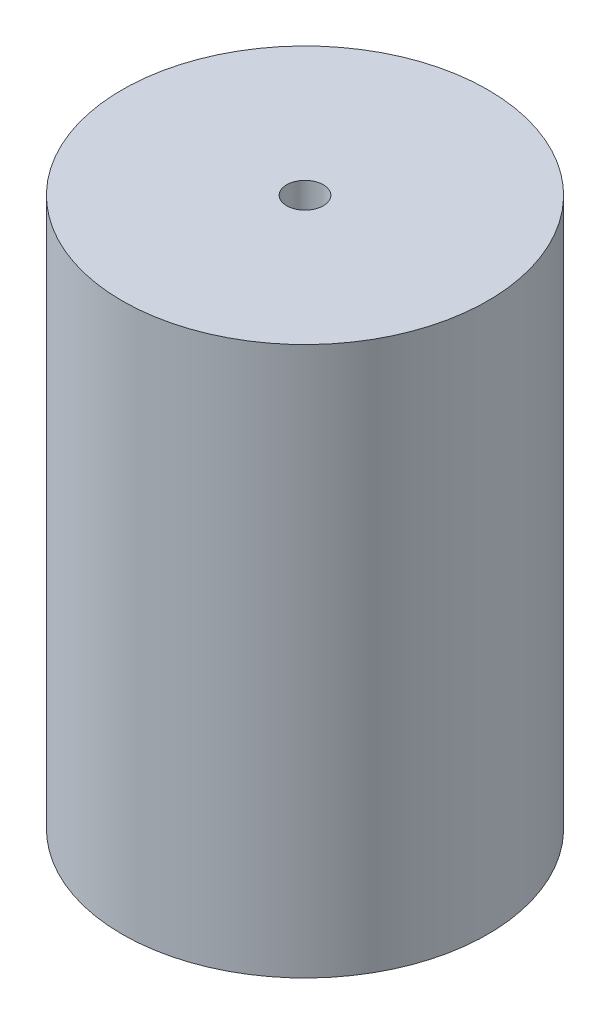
SolidWorks part; units mm, degrees
ref_plane "Front Plane" through (0, 0, 0) normal (0, 0, 1) x (1, 0, 0)
ref_plane "Top Plane" through (0, 0, 0) normal (0, 1, 0) x (1, 0, 0)
ref_plane "Right Plane" through (0, 0, 0) normal (1, 0, 0) x (0, 0, -1)
sketch "Sketch1" plane through (0, 0, 0) normal (0, 1, 0) x (1, 0, 0)
  circle A0 centre (0, 0) radius 31.75
  circle A1 centre (0, 0) radius 3.175
  dimension "D1" = 63.5
  dimension "D2" = 6.35
extrude "Boss-Extrude1" add sketch "Sketch1" along normal blind 95.25
